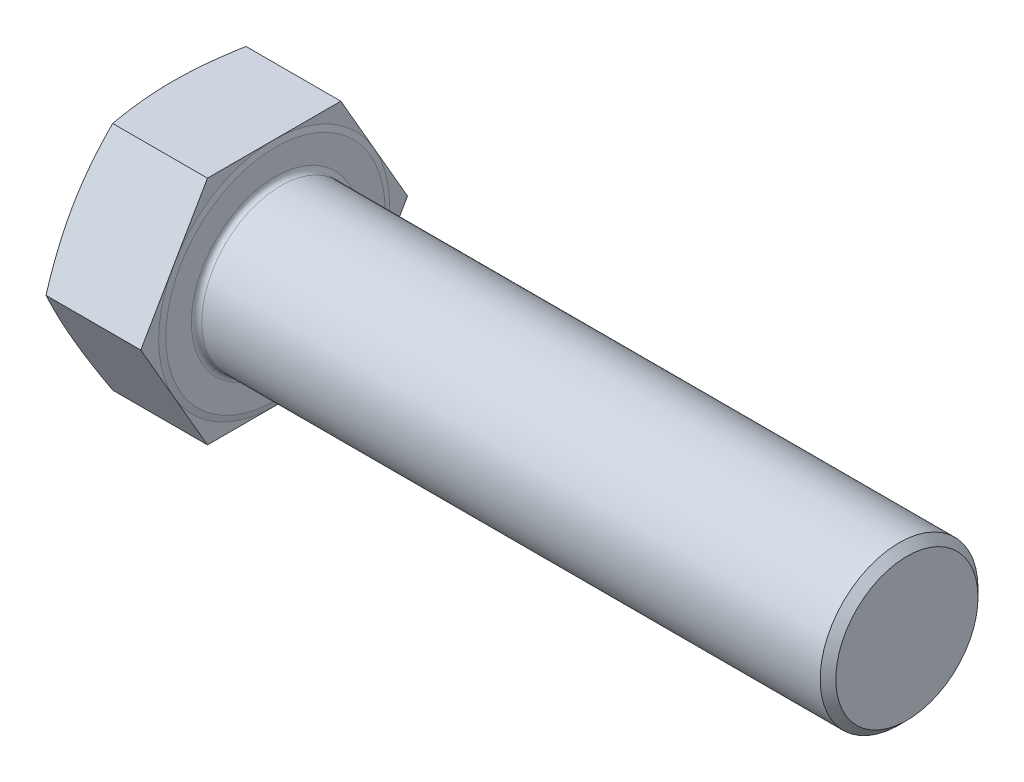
SolidWorks part; units mm, degrees
ref_plane "Front" through (0, 0, 0) normal (0, 0, 1) x (1, 0, 0)
ref_plane "Top" through (0, 0, 0) normal (0, 1, 0) x (1, 0, 0)
ref_plane "Right" through (0, 0, 0) normal (1, 0, 0) x (0, 0, -1)
sketch "Sketch-BaseHead" plane through (0, 0, 0) normal (1, 0, 0) x (0, 0, -1)
  line L1 (50.6914, 0) -> (25.3457, 43.9)
  line L2 (25.3457, 43.9) -> (-25.3457, 43.9)
  line L3 (-25.3457, 43.9) -> (-50.6914, 0)
  line L4 (-50.6914, 0) -> (-25.3457, -43.9)
  line L5 (-25.3457, -43.9) -> (25.3457, -43.9)
  line L6 (25.3457, -43.9) -> (50.6914, 0)
  circle A0 centre (0, 0) radius 43.9 construction
  dimension "s" = 87.8
extrude "BaseHead" add sketch "Sketch-BaseHead" along normal blind 38.5
sketch "Sketch4" plane through (-0.2646, 0, 5.9169) normal (0, 1, 0) x (0, 0, -1)
  line L0 (5.9169, 3.7369) -> (5.9169, -10.4477) construction
  line L2 (56.6083, -0.2646) -> (49.8169, -0.2646)
  line L4 (49.8169, -0.2646) -> (56.6083, -2.7365)
  line L6 (56.6083, -2.7365) -> (56.6083, -0.2646)
  dimension "D1" = 20
  dimension "D2" = 87.8
revolve "HeadChamfer" cut sketch "Sketch4" angle 360 about L0
sketch "Sketch1" plane through (0, 0, 0) normal (0, 0, 1) x (1, 0, 0)
  line L0 (38.5, 0) -> (39, 0)
  line L1 (39, 0) -> (39, -41.705)
  line L2 (39, -41.705) -> (38.5, -43.9)
  line L3 (38.5, -43.9) -> (38.5, 0) construction
  line L4 (0, 0) -> (7.5821, 0) construction
  line L5 (-4.0016, 0) -> (10.1831, 0) construction
  line L6 (38.5, -43.9) -> (2.4719, -43.9) construction
  line L7 (38.5, 0) -> (38.5, -43.9)
  dimension "D1" = 43.9
  dimension "c" = 0.5
  dimension "D2" = 41.705
revolve "Revolve1" add sketch "Sketch1" angle 360 about axis through (-4.0016, 0, 0) along (1, 0, 0)
ref_plane "Plane2" through (134, 0, 0) normal (1, 0, 0) x (0, 0, -1)
sketch "Sketch3" plane through (39, 0, 0) normal (1, 0, 0) x (0, 0, -1)
  circle A0 centre (0, 0) radius 30
  dimension "d" = 60
extrude "BaseBody" add sketch "Sketch3" along normal blind 240
fillet "HeadFillet" radius 2 1 edges at (39, 0, -30)
chamfer "Chamfer1" distance 2.977 angle 45 1 edges at (279, 0, -30)
equation "\"D1@Sketch1\" = \"s@Sketch-BaseHead\"/ 2"
equation "\"D2@Sketch4\" = \"s@Sketch-BaseHead\""
equation "\"D1@Chamfer1\" =  ( \"d@Sketch3\" - \"D2@ThreadCosmetic1\" ) / 2 "
equation "\"b@ThreadCosmetic1\" = \"l@BaseBody\" - \"lg@Plane2\""
